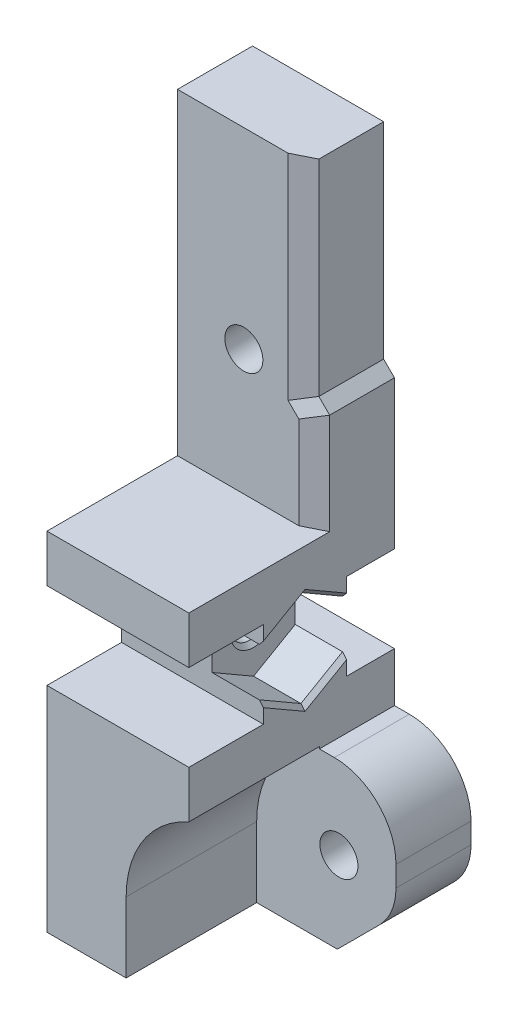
SolidWorks part; units mm, degrees
ref_plane "Front Plane" through (0, 0, 0) normal (0, 0, 1) x (1, 0, 0)
ref_plane "Top Plane" through (0, 0, 0) normal (0, 1, 0) x (1, 0, 0)
ref_plane "Right Plane" through (0, 0, 0) normal (1, 0, 0) x (0, 0, -1)
sketch "Sketch1" plane through (0, 0, 0) normal (0, 0, 1) x (1, 0, 0)
  line L1 (0, 0) -> (13.8, 0)
  line L2 (0, 0) -> (0, 17.6)
  line L3 (0, 17.6) -> (13.8, 17.6)
  line L4 (13.8, 0) -> (13.8, 17.6)
  dimension "D1" = 17.6
  dimension "D2" = 13.8
extrude "Boss-Extrude1" add sketch "Sketch1" along normal blind 20
sketch "Sketch2" plane through (0, 0, 0) normal (0, 0, -1) x (-1, 0, 0)
  line L0 (-21.25, -0.2) -> (-17.95, -0.2) construction
  line L1 (-21.25, -0.2) -> (-21.25, -16.2)
  line L2 (-17.95, -16.2) -> (-52.25, -16.2) construction
  line L3 (-21.25, -16.2) -> (0, -16.2)
  line L4 (0, -16.2) -> (0, 0)
  line L5 (0, 0) -> (-13.8, 0)
  line L6 (-21.25, -6.7) -> (-21.25, -0.2) construction
  line L7 (-21.25, -0.2) -> (-13.8, -0.2)
  line L8 (-13.8, -0.2) -> (-13.8, 0)
extrude "Boss-Extrude2" add sketch "Sketch2" against normal blind 7.3
sketch "Sketch3" plane through (0, 0, 0) normal (0, 0, -1) x (-1, 0, 0)
  line L0 (-13.8, 17.6) -> (-21.25, 17.6)
  line L1 (-21.25, 17.6) -> (-21.25, 24.1)
  line L2 (-21.25, 23.0151) -> (-21.25, 24.3) construction
  line L3 (-21.25, 24.1) -> (-17.1172, 24.1)
  line L4 (-17.1172, 24.1) -> (-12.75, 28.4672)
  line L5 (-12.75, 28.4672) -> (-12.75, 48.4672)
  line L6 (-12.75, 48.4672) -> (0, 48.4672)
  line L7 (0, 48.4672) -> (0, 17.6)
  line L9 (-12.95, 39.8) -> (-12.95, 28.55) construction
  line L11 (-17.2, 24.3) -> (-12.95, 28.55) construction
  line L13 (-13.8, 17.6) -> (0, 17.6)
  line L14 (-21.45, 24.3) -> (-17.2, 24.3) construction
  dimension "D1" = 0.2
  dimension "D2" = 0.2
  dimension "D3" = 0.2
  dimension "D4" = 20
extrude "Boss-Extrude3" add sketch "Sketch3" against normal blind 7.3
sketch "Sketch4" plane through (0, 0, 7.3) normal (0, 0, 1) x (1, 0, 0)
  line L0 (7.7, -16.2) -> (7.7, -9.3724)
  line L1 (21.25, -16.2) -> (0, -16.2) construction
  line L3 (7.7, -9.3724) -> (7.7, -9.2724) construction
  line L4 (13.8, 0) -> (0, 0)
  line L5 (0, 0) -> (0, -16.2)
  line L6 (0, -16.2) -> (7.7, -16.2)
  arc A0 (7.7, -9.3724) -> (13.8, 0) centre (17.9501, -9.3724) cw
  circle A1 centre (15.7, -8.2) radius 1.85 construction
  dimension "D1" = 8
  dimension "D2" = 0.1
extrude "Boss-Extrude4" add sketch "Sketch4" along normal up to surface (12.7 mm away)
sketch "Sketch6" plane through (0, 0, 7.3) normal (0, 0, 1) x (1, 0, 0)
  line L0 (13.8, 17.6) -> (13.8, 27.4172)
  line L1 (12.75, 28.4672) -> (17.1172, 24.1) construction
  line L2 (13.8, 27.4172) -> (17.1172, 24.1)
  line L3 (17.1172, 24.1) -> (21.25, 24.1)
  line L4 (17.1172, 24.1) -> (21.25, 24.1) construction
  line L5 (21.25, 23.0151) -> (21.25, 24.3) construction
  line L6 (21.25, 24.1) -> (21.25, 17.6)
  line L7 (21.25, 17.6) -> (13.8, 17.6)
extrude "Cut-Extrude1" cut sketch "Sketch6" against normal through all
sketch "Sketch7" plane through (0, 0, 7.3) normal (0, 0, 1) x (1, 0, 0)
  line L1 (21.25, -0.2) -> (21.25, -16.2) construction
  line L2 (21.25, -16.2) -> (7.7, -16.2) construction
  circle A0 centre (15.7, -8.2) radius 1.85
  dimension "D1" = 3.7
  dimension "D2" = 5.55
  dimension "D3" = 8
extrude "Cut-Extrude2" cut sketch "Sketch7" against normal through all
sketch "Sketch8" plane through (0, 0, 7.3) normal (0, 0, 1) x (1, 0, 0)
  circle A0 centre (6.45, 29.8) radius 1.85
extrude "Cut-Extrude3" cut sketch "Sketch8" against normal through all
sketch "Sketch9" plane through (0, 0, 0) normal (0, 0, -1) x (-1, 0, 0)
  line L0 (0, 48.4672) -> (0, -16.2) construction
  line L1 (-10.5, 32.1383) -> (-10.5, 27.4617)
  line L2 (-10.5, 27.4617) -> (-6.45, 25.1235)
  line L3 (-6.45, 25.1235) -> (-2.4, 27.4617)
  line L4 (-2.4, 27.4617) -> (-2.4, 32.1383)
  line L5 (-2.4, 32.1383) -> (-6.45, 34.4765)
  line L6 (-6.45, 34.4765) -> (-10.5, 32.1383)
  line L7 (-15.7, -12.8765) -> (-11.65, -10.5383)
  line L8 (-11.65, -10.5383) -> (-11.65, -5.8617)
  line L9 (-11.65, -5.8617) -> (-15.7, -3.5235)
  line L10 (-15.7, -3.5235) -> (-19.75, -5.8617)
  line L11 (-19.75, -5.8617) -> (-19.75, -10.5383)
  line L12 (-19.75, -10.5383) -> (-15.7, -12.8765)
  line L13 (-21.25, -0.2) -> (-21.25, -16.2) construction
  circle A0 centre (-6.45, 29.8) radius 4.05 construction
  circle A1 centre (-15.7, -8.2) radius 4.05 construction
  dimension "D1" = 8.1
  dimension "D2" = 8.1
extrude "Cut-Extrude4" cut sketch "Sketch9" against normal blind 4
sketch "Sketch10" plane through (0, 0, 0) normal (-1, 0, 0) x (0, 0, 1)
  line L0 (15.4034, 14.8) -> (15.4034, 2.8) construction
  line L1 (20, 14.8) -> (10.7487, 14.8) construction
  line L2 (9.2476, 2.8) -> (20, 2.8) construction
  line L3 (15.4034, 8.8) -> (0, 8.8) construction
  line L4 (0, 48.4672) -> (0, -16.2) construction
  line L11 (0, 13) -> (4.65, 13)
  line L12 (0, 13) -> (0, 4.6)
  line L13 (0, 4.6) -> (4.65, 4.6)
  line L14 (4.65, 13) -> (4.65, 4.6)
  dimension "D2" = 4.65
  dimension "D3" = 4.2
  dimension "D4" = 4.2
extrude "Cut-Extrude5" cut sketch "Sketch10" against normal through all
sketch "Sketch12" plane through (13.8, 0, 0) normal (1, 0, 0) x (0, 0, -1)
  line L0 (-4.65, 8.8) -> (-20, 8.8) construction
  line L1 (-8.7, 4.1235) -> (-4.65, 6.4617)
  line L2 (-4.65, 6.4617) -> (-4.65, 11.1383)
  line L3 (-4.65, 11.1383) -> (-8.7, 13.4765)
  line L4 (-8.7, 13.4765) -> (-12.75, 11.1383)
  line L5 (-12.75, 11.1383) -> (-12.75, 6.4617)
  line L6 (-12.75, 6.4617) -> (-8.7, 4.1235)
  line L7 (-20, 0) -> (-20, 17.6) construction
  line L8 (-4.65, 4.6) -> (-4.65, 13) construction
  circle A0 centre (-8.7, 8.8) radius 4.05 construction
  dimension "D1" = 8.1
extrude "Cut-Extrude7" cut sketch "Sketch12" against normal blind 5
sketch "Sketch15" plane through (8.8, 0, 0) normal (1, 0, 0) x (0, 0, -1)
  line L0 (-8.7, 13.4765) -> (-8.7, 4.1235) construction
  circle A0 centre (-8.7, 8.8) radius 1.85
  dimension "D1" = 3.7
extrude "Cut-Extrude10" cut sketch "Sketch15" against normal up to surface (8.8 mm away)
sketch "Sketch13" plane through (0, 0, 0) normal (-1, 0, 0) x (0, 0, 1)
  line L0 (20, 17.6) -> (20, -16.2) construction
  line L1 (20, 4.6) -> (12.75, 4.6)
  line L2 (20, 4.6) -> (20, 13)
  line L3 (20, 13) -> (12.75, 13)
  line L4 (12.75, 4.6) -> (12.75, 13)
  line L5 (0, 4.6) -> (4.65, 4.6) construction
  line L6 (4.65, 13) -> (0, 13) construction
  line L8 (12.75, 11.1383) -> (12.75, 6.4617) construction
extrude "Cut-Extrude8" cut sketch "Sketch13" against normal through all
sketch "Sketch14" plane through (0, 0, 0) normal (0, 0, -1) x (-1, 0, 0)
  line L0 (-15.7, -8.2) -> (-21.25, -8.2) construction
  line L1 (-21.25, -0.2) -> (-21.25, -16.2) construction
  line L2 (-15.7, -8.2) -> (-15.7, -16.2) construction
  line L3 (-21.25, -16.2) -> (0, -16.2) construction
  line L4 (-15.7, -8.2) -> (-21.25, -13.75) construction
  line L5 (-19.6244, -12.1244) -> (-15.5489, -16.2)
  line L6 (-15.5489, -16.2) -> (-21.25, -16.2)
  line L7 (-21.25, -16.2) -> (-21.25, -8.2)
  arc A0 (-21.25, -8.2) -> (-19.6244, -12.1244) centre (-15.7, -8.2) ccw
  circle A1 centre (-15.7, -8.2) radius 1.85 construction
  dimension "D1" = 45
extrude "Cut-Extrude9" cut sketch "Sketch14" against normal through all
chamfer "Chamfer1" distance 2 distance2 1 3 edges at (12.75, 38.4672, 7.3) (13.8, 22.5086, 7.3) (13.275, 27.9422, 7.3)
chamfer "Chamfer2" distance 0.4 angle 45 1 edges at (8.8, 8.8, 6.85)
chamfer "Chamfer3" distance 0.4 angle 45 4 edges at (13.8, 5.2926, 10.725) (13.8, 5.2926, 6.675) (13.8, 12.3074, 10.725) (13.8, 12.3074, 6.675)
fillet "Fillet1" radius 6 1 edges at (21.25, -0.2, 3.65)
equation "\"D2@Sketch9\"=\"D1@Sketch9\""
equation "\"D4@Sketch10\"=\"D3@Sketch10\""
